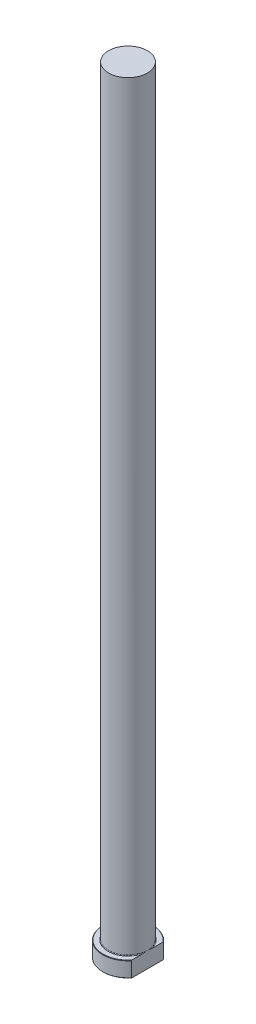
SolidWorks part; units mm, degrees
ref_plane "Front Plane" through (0, 0, 0) normal (0, 0, 1) x (1, 0, 0)
ref_plane "Top Plane" through (0, 0, 0) normal (0, 1, 0) x (1, 0, 0)
ref_plane "Right Plane" through (0, 0, 0) normal (1, 0, 0) x (0, 0, -1)
sketch "Sketch1" plane through (0, 0, 0) normal (0, 0, 1) x (1, 0, 0)
  line L0 (0, 259.9588) -> (0, -15.1925) construction
  line L1 (0, 0) -> (-13, 0)
  line L2 (-13, 0) -> (-13, 8)
  line L3 (-13, 8) -> (-10, 8)
  line L4 (-10, 8) -> (-10, 400)
  line L5 (-10, 400) -> (0, 400)
  line L6 (0, 400) -> (0, 0)
  dimension "L" = 400
  dimension "H" = 26
  dimension "T" = 8
  dimension "D" = 20
revolve "Revolve1" add sketch "Sketch1" angle 360 about L0
chamfer "Chamfer1" distance 0.2 angle 45 2 edges at (0, 8, 13) (0, 0, 13)
fillet "Fillet1" radius 0.3 1 edges at (0, 8, 10)
sketch "Sketch2" plane through (0, 0, 0) normal (0, 1, 0) x (1, 0, 0)
  line L0 (10, 8.3066) -> (10, -8.3066)
  circle A0 centre (0, 0) radius 13 construction
  arc A1 (10, -8.3066) -> (10, 8.3066) centre (0, 0) ccw
  circle A2 centre (0, 0) radius 10 construction
extrude "KEY" cut sketch "Sketch2" along normal through all
